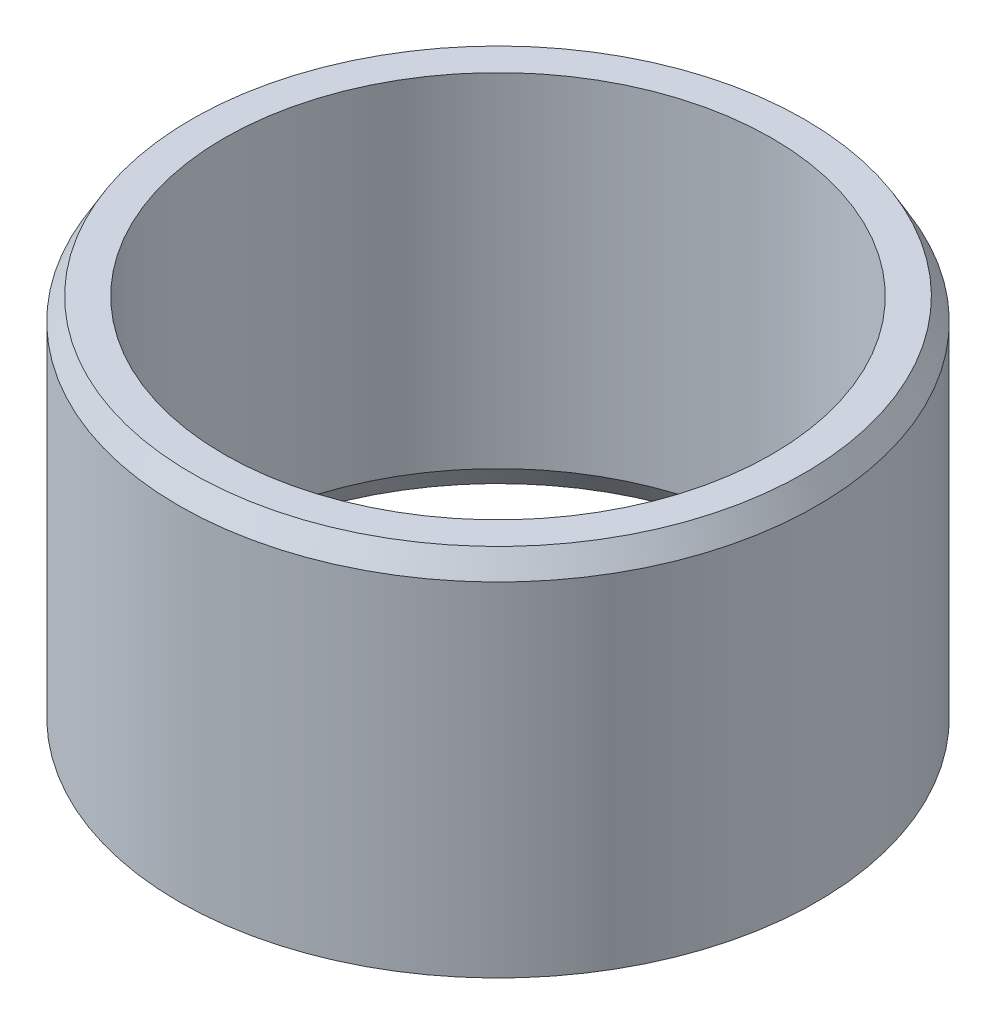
SolidWorks part; units mm, degrees
ref_plane "FRONT" through (0, 0, 0) normal (0, 0, 1) x (1, 0, 0)
ref_plane "FLOOR" through (0, 0, 0) normal (0, 1, 0) x (1, 0, 0)
ref_plane "RIGHT" through (0, 0, 0) normal (1, 0, 0) x (0, 0, -1)
sketch "Sketch1" plane through (0, 0, 0) normal (0, 0, 1) x (1, 0, 0)
  line L0 (9.9738, 0) -> (11.1087, 0)
  line L1 (11.1087, 0) -> (11.1087, 11.938)
  line L2 (11.1087, 11.938) -> (10.6687, 12.7)
  line L3 (10.6687, 12.7) -> (9.5339, 12.7)
  line L4 (9.5339, 12.7) -> (9.5339, 0.762)
  line L5 (9.5339, 0.762) -> (9.9738, 0)
  line L6 (0, -4.4877) -> (0, 22.6504) construction
  dimension "D1" = 30
  dimension "D2" = 30
  dimension "OD CHAMFER" = 0.762
  dimension "ID CHAMFER" = 0.762
  dimension "LENGTH" = 12.7
  dimension "ID" = 19.0678
  dimension "OD" = 22.2174
revolve "IGLIDE" add sketch "Sketch1" angle 360 about L6
